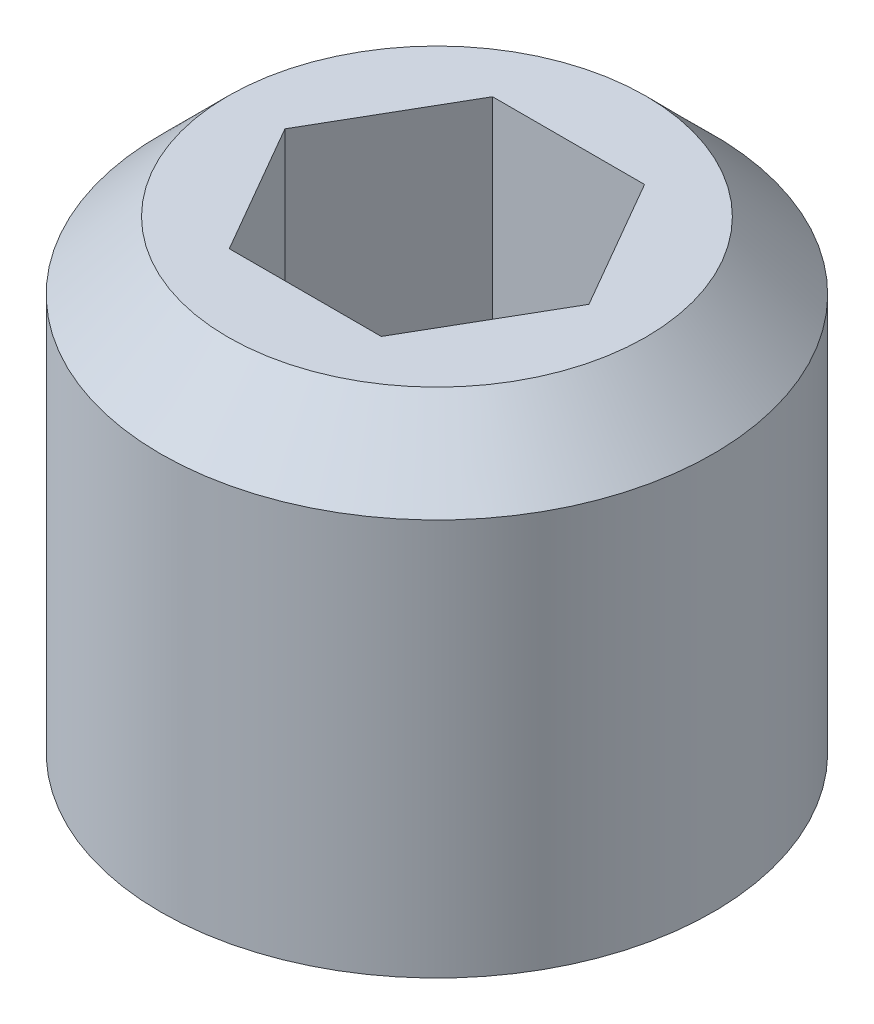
SolidWorks part; units mm, degrees
ref_plane "Front" through (0, 0, 0) normal (0, 0, 1) x (1, 0, 0)
ref_plane "Top" through (0, 0, 0) normal (0, 1, 0) x (1, 0, 0)
ref_plane "Right" through (0, 0, 0) normal (1, 0, 0) x (0, 0, -1)
sketch "Sketch1" plane through (0, 0, 0) normal (0, 0, 1) x (1, 0, 0)
  line L0 (0, 0) -> (1.5748, 0)
  line L1 (2.2911, 0) -> (-2.2911, 0) construction
  line L2 (1.5748, 0) -> (2.0828, -0.508)
  line L3 (2.0828, -0.508) -> (2.0828, -3.4983)
  line L4 (2.0828, -3.4983) -> (0, -4.7498)
  line L5 (0, -2.2911) -> (0, 2.2911) construction
  line L6 (0, -4.7498) -> (0, 0)
  line L7 (0, 12.1646) -> (0, -27.5878) construction
  line L8 (-2.0828, -3.4983) -> (0, -4.7498) construction
  dimension "D1" = 4.1656
  dimension "D2" = 4.7498
  dimension "D3" = 118
  dimension "D4" = 45
  dimension "D5" = 0.508
revolve "Revolve1" add sketch "Sketch1" angle 360 about L7
sketch "Sketch2" plane through (0, 0, 0) normal (0, 1, 0) x (-1, 0, 0)
  line L0 (2.2911, 0) -> (-2.2911, 0) construction
  line L1 (-1.1457, 0) -> (-0.5728, -0.9922)
  line L2 (-0.5728, -0.9922) -> (0.5728, -0.9922)
  line L3 (0.5728, -0.9922) -> (1.1457, 0)
  line L4 (1.1457, 0) -> (0.5728, 0.9922)
  line L5 (0.5728, 0.9922) -> (-0.5728, 0.9922)
  line L6 (-0.5728, 0.9922) -> (-1.1457, 0)
  circle A0 centre (0, 0) radius 0.9922 construction
  dimension "D1" = 1.9844
extrude "Cut-Extrude1" cut sketch "Sketch2" against normal blind 2.286
